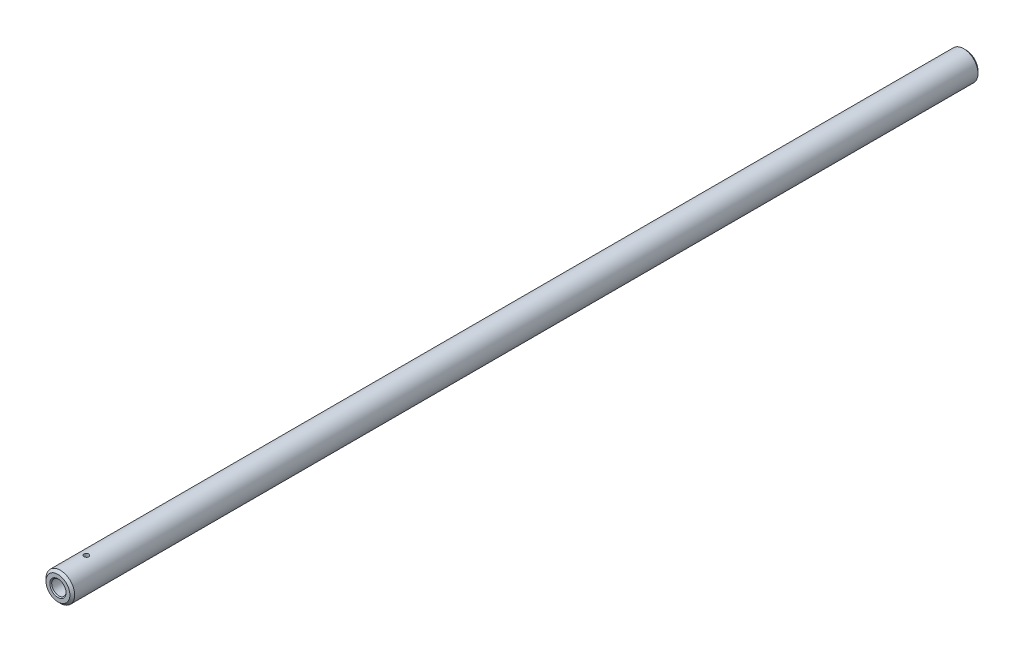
SolidWorks part; units mm, degrees
ref_plane "Plan de face" through (0, 0, 0) normal (0, 0, 1) x (1, 0, 0)
ref_plane "Plan de dessus" through (0, 0, 0) normal (0, 1, 0) x (1, 0, 0)
ref_plane "Plan de droite" through (0, 0, 0) normal (1, 0, 0) x (0, 0, -1)
sketch "Esquisse1" plane through (0, 0, 0) normal (0, 0, 1) x (1, 0, 0)
  circle A0 centre (0, 0) radius 3
  dimension "D1" = 6
extrude "Boss.-Extru.1" add sketch "Esquisse1" along normal blind 190
sketch "Esquisse2" plane through (0, 0, 190) normal (0, 0, 1) x (1, 0, 0)
  circle A0 centre (0, 0) radius 1.5
  dimension "D1" = 3
extrude "Enlèv. mat.-Extru.1" cut sketch "Esquisse2" against normal blind 10
chamfer "Chanfrein1" distance 0.2 angle 45 1 edges at (1.5, 0, 190)
chamfer "Chanfrein2" distance 0.5 angle 45 2 edges at (3, 0, 0) (3, 0, 190)
sketch "Esquisse3" plane through (0, 0, 0) normal (0, 1, 0) x (1, 0, 0)
  line L0 (0, -172.2406) -> (0, -192.1645) construction
  circle A0 centre (0, -184.0766) radius 0.5
  dimension "D1" = 1
extrude "Enlèv. mat.-Extru.2" cut sketch "Esquisse3" against normal mid plane 10
